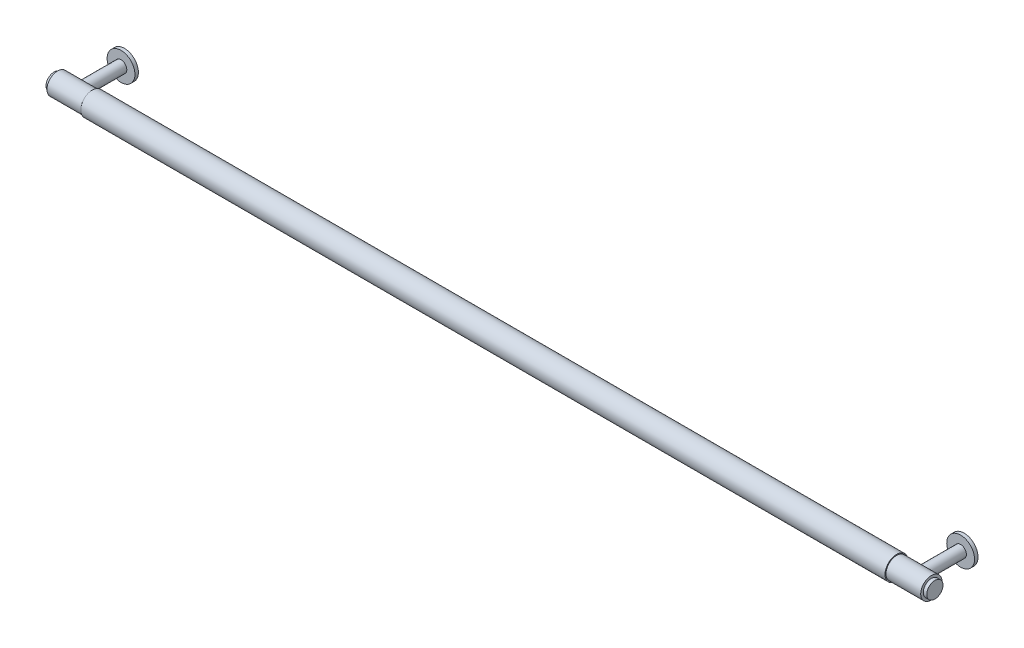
SolidWorks part; units mm, degrees
ref_plane "Front Plane" through (0, 0, 0) normal (0, 0, 1) x (1, 0, 0)
ref_plane "Top Plane" through (0, 0, 0) normal (0, 1, 0) x (1, 0, 0)
ref_plane "Right Plane" through (0, 0, 0) normal (1, 0, 0) x (0, 0, -1)
sketch "Sketch1" plane through (0, 0, 0) normal (1, 0, 0) x (0, 0, -1)
  circle A0 centre (0, 0) radius 10
  dimension "D1" = 20
extrude "Boss-Extrude1" add sketch "Sketch1" along normal blind 347
sketch "Sketch2" plane through (347, 0, 0) normal (1, 0, 0) x (0, 0, -1)
  circle A2 centre (0, 0) radius 9.2
  circle A3 centre (0, 0) radius 9.2
  dimension "D1" = 0.8
extrude "Boss-Extrude3" add sketch "Sketch2" along normal blind 30
sketch "Sketch3" plane through (377, 0, 0) normal (1, 0, 0) x (0, 0, -1)
  circle A0 centre (0, 0) radius 7
extrude "Boss-Extrude4" add sketch "Sketch3" along normal blind 3
mirror "Mirror1" about plane through (0, 0, 0) normal (1, 0, 0) of "Boss-Extrude4", "Boss-Extrude3", "Boss-Extrude1"
sketch "Sketch4" plane through (0, 0, 0) normal (0, 0, 1) x (1, 0, 0)
  line L0 (-380, 0) -> (-367.25, 0) construction
  line L1 (-380, 7) -> (-380, -7) construction
  line L2 (-367.25, 0) -> (-357.25, 0) construction
  line L3 (-362.25, 0) -> (-380, 0) construction
  circle A0 centre (-362.25, 0) radius 5
  dimension "D2" = 10
  dimension "D1" = 17.75
extrude "Boss-Extrude5" add sketch "Sketch4" against normal blind 40
mirror "Mirror2" about plane through (0, 0, 0) normal (1, 0, 0) of "Boss-Extrude5"
sketch "Sketch9" [suppressed] plane through (0, 0, 0) normal (1, 0, 0) x (0, 0, -1)
  line L2 (40, -11.5) -> (40, 11.5)
  line L3 (40, 11.5) -> (43, 11.5)
  line L4 (43, -11.5) -> (43, 11.5)
  line L5 (40, -11.5) -> (43, -11.5)
extrude "Boss-Extrude8" [suppressed] add sketch "Sketch9" along normal mid plane 400
sketch "Sketch10" [suppressed] plane through (0, 0, -40) normal (0, 0, 1) x (1, 0, 0)
  line L0 (0, 0) -> (90, 0) construction
  line L1 (100, 11.5) -> (100, -11.5) construction
  circle A0 centre (90, 0) radius 5
  point P4 (100, 0)
  dimension "D1" = 10
  dimension "D2" = 10
extrude "Boss-Extrude9" [suppressed] add sketch "Sketch10" along normal blind 3 contours A0
sketch "Sketch11" [suppressed] plane through (0, 0, 0) normal (0, 1, 0) x (1, 0, 0)
  line L0 (190, 37) -> (190, 38.5) construction
  line L1 (185, 37) -> (195, 37) construction
  line L2 (185, 37) -> (186, 37) construction
  line L3 (195, 37) -> (194, 37) construction
  line L6 (186, 37) -> (186, 34.6346)
  line L7 (186, 34.6346) -> (194, 34.6346)
  line L8 (194, 37) -> (194, 34.6346)
  arc A0 (186, 37) -> (194, 37) centre (190, 32.5279) cw
  dimension "D3" = 6
  dimension "D1" = 1
  dimension "D2" = 1
extrude "Cut-Extrude1" [suppressed] cut sketch "Sketch11" against normal mid plane 2
mirror "Mirror3" [suppressed] about plane through (0, 0, 0) normal (1, 0, 0)
sketch "Sketch13" plane through (0, 0, -40) normal (0, 0, -1) x (-1, 0, 0)
  circle A0 centre (-362.25, 0) radius 12
  dimension "D1" = 24
extrude "Boss-Extrude10" add sketch "Sketch13" along normal blind 3
mirror "Mirror4" about plane through (0, 0, 0) normal (1, 0, 0) of "Boss-Extrude10"
